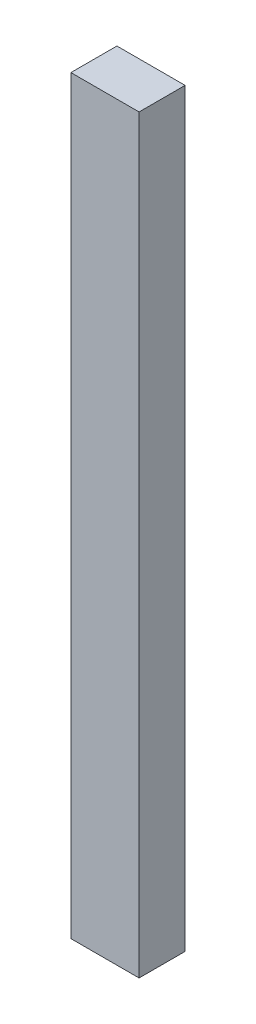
SolidWorks part; units mm, degrees
ref_plane "Plan de face" through (0, 0, 0) normal (0, 0, 1) x (1, 0, 0)
ref_plane "Plan de dessus" through (0, 0, 0) normal (0, 1, 0) x (1, 0, 0)
ref_plane "Plan de droite" through (0, 0, 0) normal (1, 0, 0) x (0, 0, -1)
sketch "Esquisse1" plane through (0, 0, 0) normal (0, 0, 1) x (1, 0, 0)
  line L1 (410, 480) -> (450, 480)
  line L2 (410, 480) -> (410, 40)
  line L3 (410, 40) -> (450, 40)
  line L4 (450, 480) -> (450, 40)
extrude "Boss.-Extru.1" add sketch "Esquisse1" against normal blind 27
